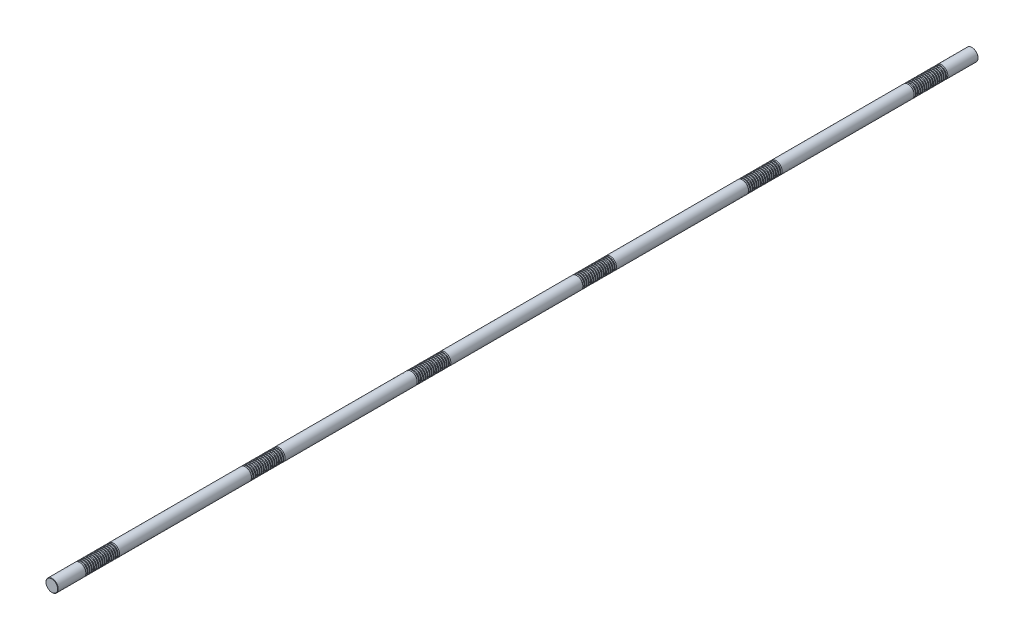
SolidWorks part; units mm, degrees
ref_plane "Front Plane" through (0, 0, 0) normal (0, 0, 1) x (1, 0, 0)
ref_plane "Top Plane" through (0, 0, 0) normal (0, 1, 0) x (1, 0, 0)
ref_plane "Right Plane" through (0, 0, 0) normal (1, 0, 0) x (0, 0, -1)
sketch "Sketch1" plane through (0, 0, 0) normal (0, 0, 1) x (1, 0, 0)
  circle A0 centre (0, 0) radius 20
  dimension "D1" = 40
extrude "Boss-Extrude1" add sketch "Sketch1" along normal mid plane 3000
chamfer "Chamfer1" distance 1 angle 45 2 edges at (20, 0, -1500) (20, 0, 1500)
sketch "Sketch2" plane through (0, 0, 0) normal (1, 0, 0) x (0, 0, -1)
  line L0 (1400.5359, 20) -> (1395.9641, 20)
  line L1 (1499, 20) -> (-1499, 20) construction
  line L2 (1395.9641, 20) -> (1397.0359, 16)
  line L3 (1397.0359, 16) -> (1399.4641, 16)
  line L4 (1399.4641, 16) -> (1400.5359, 20)
  line L5 (1500, -19) -> (1500, 19) construction
  point P4 (1398.25, 20)
  point P7 (1398.25, 16)
  point P8 (1400, 18)
  point P9 (1396.5, 18)
  dimension "D1" = 3.5
  dimension "D2" = 100
  dimension "D3" = 4
  dimension "D4" = 30
revolve "Cut-Revolve1" cut sketch "Sketch2" angle 360 about axis through (0, 0, 1500) along (0, 0, -1)
pattern_linear "LPattern1" count 16 spacing 7 along (0, 0, 1) of "Cut-Revolve1"
pattern_linear "LPattern2" count 6 spacing 540 along (0, 0, 1) of "Cut-Revolve1", "LPattern1"
